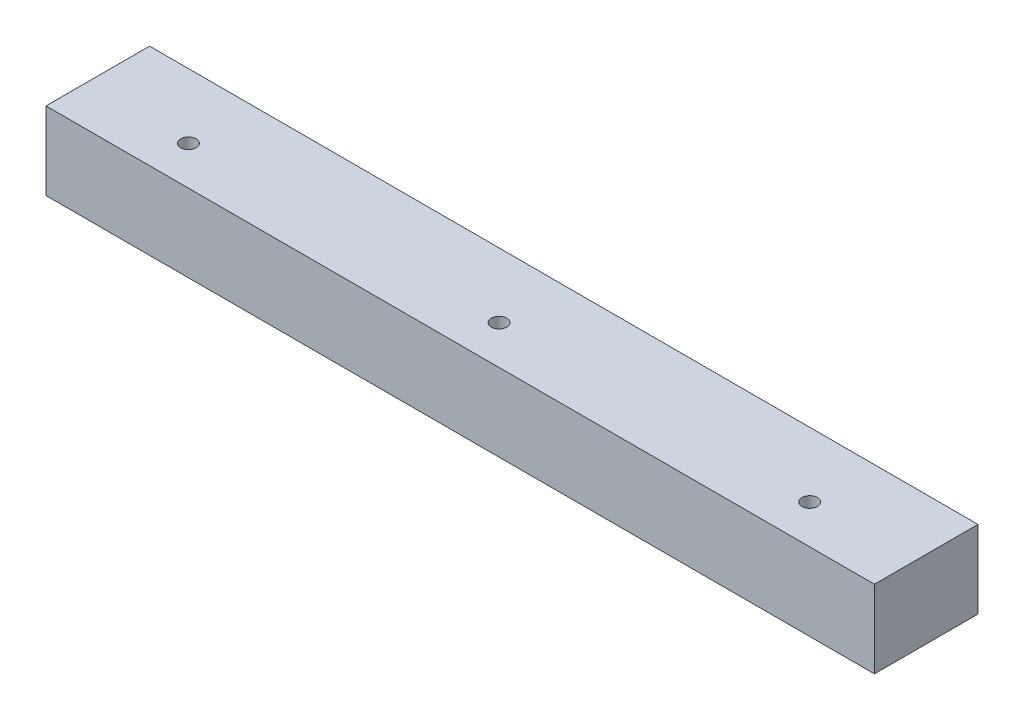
SolidWorks part; units mm, degrees
ref_plane "Front Plane" through (0, 0, 0) normal (0, 0, 1) x (1, 0, 0)
ref_plane "Top Plane" through (0, 0, 0) normal (0, 1, 0) x (1, 0, 0)
ref_plane "Right Plane" through (0, 0, 0) normal (1, 0, 0) x (0, 0, -1)
sketch "Sketch1" plane through (0, 0, 0) normal (0, 1, 0) x (1, 0, 0)
  line L0 (0, 0) -> (-203.2, 0)
  line L1 (0, 0) -> (0, 25.4)
  line L2 (-203.2, 0) -> (-203.2, 25.4)
  line L3 (0, 25.4) -> (-203.2, 25.4)
  dimension "D1" = 203.2
  dimension "D2" = 25.4
extrude "Boss-Extrude1" add sketch "Sketch1" along normal blind 19.05
hole_wizard "Tap Drill for #10-24 Tap1" positions "Sketch5" profile "Sketch4" hole size "#10-24" standard "ANSI Inch"
sketch "Sketch5" plane through (0, 0, 0) normal (0, -1, 0) x (-1, 0, 0)
  line L0 (0, 0) -> (0, 25.4) construction
  line L1 (203.2, 0) -> (0, 0) construction
  point P0 (25.4, 9.525)
  dimension "D1" = 25.4
  dimension "D2" = 9.525
sketch "Sketch4" plane through (-25.4, 0, -9.525) normal (1, 0, 0) x (0, 0, -1)
  line L0 (0, 0) -> (0, 19.05)
  line L1 (0, 19.05) -> (1.8986, 19.05)
  line L2 (1.8986, 19.05) -> (1.8986, 0)
  line L5 (1.8986, 0) -> (0, 0)
  line L11 (0, -6.35) -> (0, 107.95) construction
  dimension "Thru Hole Dia." = 3.7973
  dimension "Thru Hole Depth" = 19.05
pattern_linear "LPattern1" count 1 spacing 76.2 along (-1, 0, 0) count 3 spacing 76.2 along (-1, 0, 0) of "Tap Drill for #10-24 Tap1"
